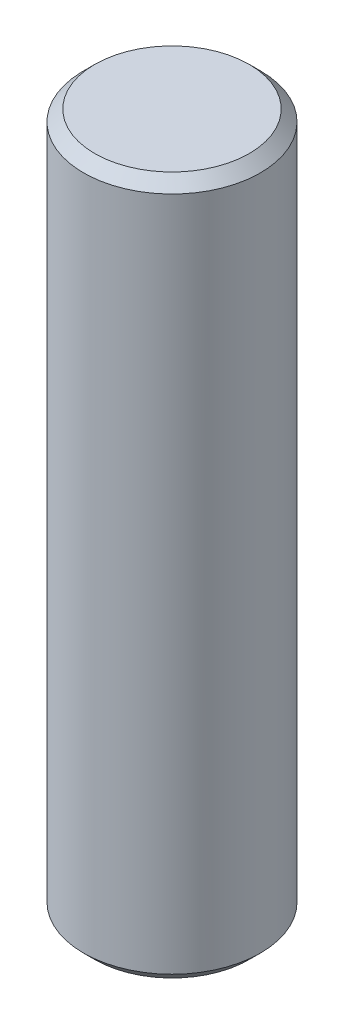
SolidWorks part; units mm, degrees
ref_plane "Front" through (0, 0, 0) normal (0, 0, 1) x (1, 0, 0)
ref_plane "Top" through (0, 0, 0) normal (0, 1, 0) x (1, 0, 0)
ref_plane "Right" through (0, 0, 0) normal (1, 0, 0) x (0, 0, -1)
sketch "Sketch1" plane through (0, 0, 0) normal (0, 1, 0) x (1, 0, 0)
  circle A0 centre (0, 0) radius 2.413
  dimension "D1" = 4.826
extrude "Extrude1" add sketch "Sketch1" along normal blind 19.05
chamfer "Chamfer1" distance 0.3048 angle 45 2 edges at (0, 0, 2.413) (0, 19.05, 2.413)
